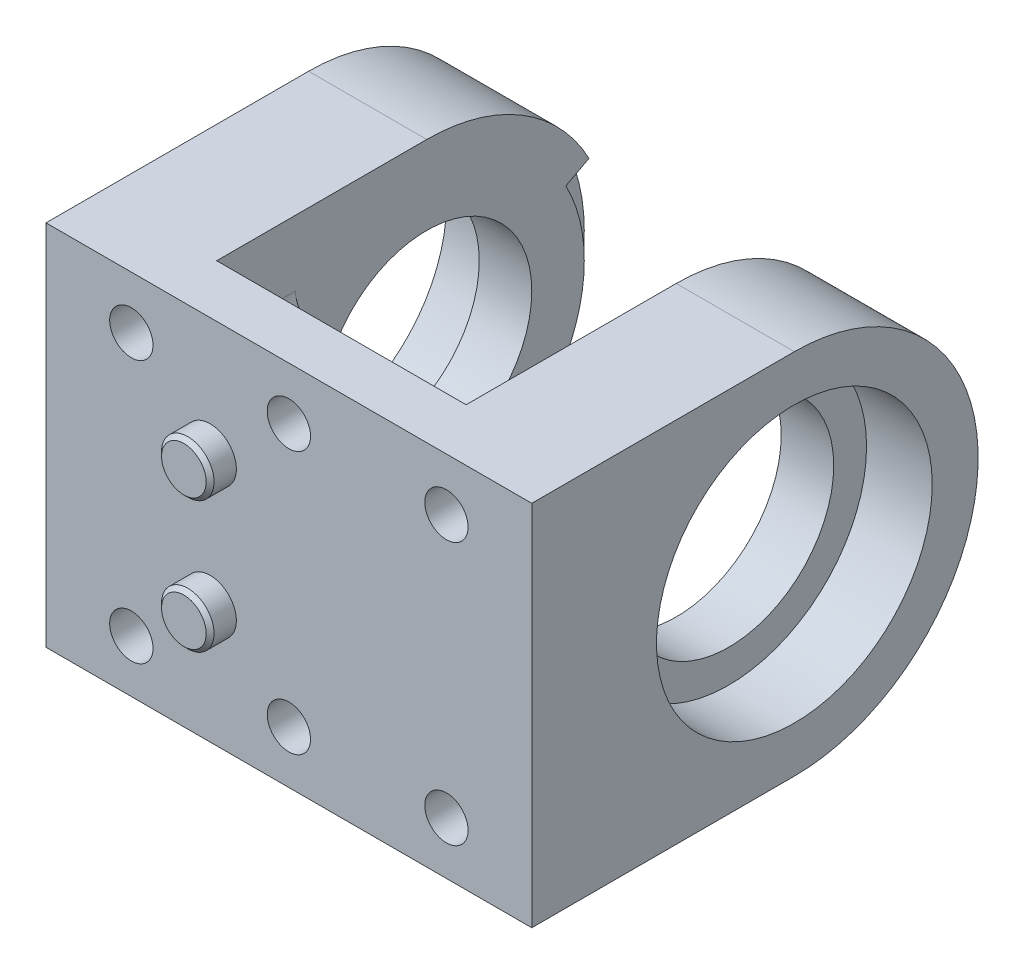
SolidWorks part; units mm, degrees
ref_plane "前视基准面" through (0, 0, 0) normal (0, 0, 1) x (1, 0, 0)
ref_plane "上视基准面" through (0, 0, 0) normal (0, 1, 0) x (1, 0, 0)
ref_plane "右视基准面" through (0, 0, 0) normal (1, 0, 0) x (0, 0, -1)
sketch "草图1" plane through (0, 0, 0) normal (0, 0, 1) x (1, 0, 0)
  line L0 (0, 0) -> (-24.3515, 0) construction
  line L1 (-18.5, -14) -> (18.5, -14)
  line L2 (-18.5, -14) -> (-18.5, 14)
  line L3 (-18.5, 14) -> (18.5, 14)
  line L4 (18.5, -14) -> (18.5, 14)
  line L5 (-18.5, -14) -> (18.5, 14) construction
  line L6 (-18.5, 14) -> (18.5, -14) construction
  line L8 (-12, 10) -> (0, 10) construction
  line L9 (0, 10) -> (12, 10) construction
  circle A0 centre (0, 10) radius 1
  circle A1 centre (12, 10) radius 1
  circle A2 centre (-12, 10) radius 1
  circle A3 centre (0, -10) radius 1
  circle A4 centre (-12, -10) radius 1
  circle A5 centre (12, -10) radius 1
  point P0 (0, 0)
  dimension "D3" = 2
  dimension "D4" = 20
  dimension "D5" = 2
  dimension "D6" = 12
  dimension "D7" = 2
  dimension "D8" = 12
  dimension "D9" = 18.5
  dimension "D1" = 28
  dimension "D2" = 37
extrude "凸台-拉伸1" add sketch "草图1" along normal blind 4
sketch "草图2" plane through (0, 0, 4) normal (0, 0, 1) x (1, 0, 0)
  line L0 (18.5, 0) -> (-11.044, 0) construction
  line L2 (18.5, -14) -> (18.5, 14) construction
  line L3 (-6, 14) -> (-6, -14) construction
  line L4 (18.5, 14) -> (-18.5, 14) construction
  line L5 (-18.5, -14) -> (18.5, -14) construction
  line L6 (-18.5, 14) -> (-18.5, -14) construction
  circle A0 centre (-6, 5) radius 2
  circle A1 centre (-6, -5) radius 2
  dimension "D1" = 4
  dimension "D2" = 4
  dimension "D3" = 5
  dimension "D4" = 5
  dimension "D5" = 12.5
extrude "凸台-拉伸2" add sketch "草图2" along normal blind 2
sketch "草图3" plane through (18.5, 0, 0) normal (1, 0, 0) x (0, 0, -1)
  line L0 (-4, 0) -> (41.3557, 0) construction
  line L1 (-4, -14) -> (-4, 14) construction
  line L2 (0, 14) -> (0, -14)
  line L3 (16, 14) -> (0, 14)
  line L4 (0, -14) -> (16, -14)
  arc A0 (16, -14) -> (16, 14) centre (16, 0) ccw
  circle A1 centre (16, 0) radius 8
  dimension "D1" = 16
  dimension "D2" = 28
  dimension "D3" = 20
extrude "凸台-拉伸3" add sketch "草图3" against normal blind 9
sketch "草图4" plane through (18.5, 0, 0) normal (1, 0, 0) x (0, 0, -1)
  circle A0 centre (16, 0) radius 10.5
  dimension "D1" = 21
extrude "切除-拉伸1" cut sketch "草图4" against normal blind 5
mirror "镜向1" about plane through (0, 0, 0) normal (1, 0, 0) of "切除-拉伸1", "凸台-拉伸3"
sketch "草图5" plane through (0, 0, 0) normal (0, 0, -1) x (-1, 0, 0)
  line L0 (-9.5, -14) -> (-9.5, 14) construction
  line L1 (-9.5, 7) -> (9.5, 7)
  line L2 (-9.5, 7) -> (-9.5, 3)
  line L3 (-9.5, 3) -> (9.5, 3)
  line L4 (9.5, 7) -> (9.5, 3)
  line L5 (9.5, 14) -> (9.5, -14) construction
  line L6 (0, 0) -> (22.0972, 0) construction
  line L7 (9.5, -7) -> (9.5, -3)
  line L8 (-9.5, -3) -> (9.5, -3)
  line L9 (-9.5, -7) -> (-9.5, -3)
  line L10 (-9.5, -7) -> (9.5, -7)
  dimension "D1" = 3
  dimension "D2" = 4
extrude "凸台-拉伸4" add sketch "草图5" along normal blind 6
fillet "圆角1" radius 2 8 edges at (-9.5, -3, -3) (9.5, -3, -3) (9.5, 3, -3) (-9.5, 3, -3) (-9.5, -7, -3) (9.5, -7, -3) (-9.5, 7, -3) (9.5, 7, -3)
hole_wizard "M4 螺纹孔1" positions "3D草图1" profile "草图6" tap size "M4" standard "GB"
sketch3d "3D草图1"
  line L0 (12, -10, 4) -> (12, -10, 0) construction
  line L1 (0, -10, 4) -> (0, -10, 0) construction
  line L2 (-12, -10, 4) -> (-12, -10, 0) construction
  line L3 (-12, 10, 4) -> (-12, 10, 0) construction
  line L4 (0, 10, 4) -> (0, 10, 0) construction
  line L5 (12, 10, 4) -> (12, 10, 0) construction
  point P0 (12, -10, 4)
  point P4 (0, -10, 4)
  point P8 (-12, -10, 4)
  point P12 (-12, 10, 4)
  point P16 (0, 10, 4)
  point P20 (12, 10, 4)
sketch "草图6" plane through (12, -10, 4) normal (1, 0, 0) x (0, -1, 0)
  line L0 (0, 0) -> (0, 10.0914)
  line L1 (0, 10.0914) -> (1.65, 9.1)
  line L2 (1.65, 9.1) -> (1.65, 0)
  line L5 (1.65, 0) -> (0, 0)
  line L10 (0, 10.0914) -> (-1.65, 9.1) construction
  line L11 (0, -6.35) -> (0, 107.95) construction
  dimension "螺纹孔钻头直径" = 3.3
  dimension "螺纹孔钻头深度" = 9.1
  dimension "导头角度" = 118
sketch "草图7" plane through (-9.5, 0, 0) normal (1, 0, 0) x (0, 0, -1)
  line L0 (26.5954, 5.6337) -> (28.3613, 6.5726)
  line L1 (26.5954, -5.6337) -> (28.3613, -6.5726)
  line L2 (16, 0) -> (47.6903, 0) construction
  arc A0 (26.5954, -5.6337) -> (26.5954, 5.6337) centre (16, 0) ccw
  arc A1 (28.3613, -6.5726) -> (28.3613, 6.5726) centre (16, 0) ccw
  dimension "D1" = 28
  dimension "D2" = 24
  dimension "D3" = 28
  dimension "D4" = 28
extrude "切除-拉伸2" cut sketch "草图7" against normal blind 2
chamfer "倒角1" distance 0.3 angle 45 2 edges at (-4, 5, 6) (-4, -5, 6)
